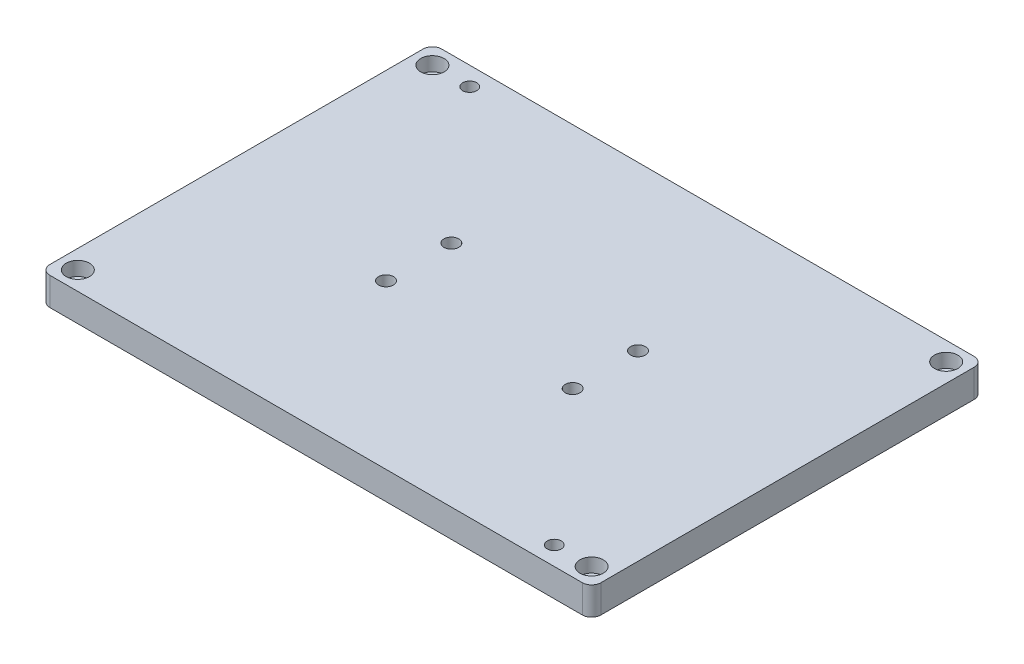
SolidWorks part; units mm, degrees
ref_plane "Front Plane" through (0, 0, 0) normal (0, 0, 1) x (1, 0, 0)
ref_plane "Top Plane" through (0, 0, 0) normal (0, 1, 0) x (1, 0, 0)
ref_plane "Right Plane" through (0, 0, 0) normal (1, 0, 0) x (0, 0, -1)
sketch "Sketch1" plane through (0, 0, 0) normal (0, 1, 0) x (1, 0, 0)
  line L1 (-187.5234, 133.35) -> (187.5234, 133.35)
  line L2 (-187.5234, 133.35) -> (-187.5234, -133.35)
  line L3 (-187.5234, -133.35) -> (187.5234, -133.35)
  line L4 (187.5234, 133.35) -> (187.5234, -133.35)
  line L5 (-187.5234, 133.35) -> (187.5234, -133.35) construction
  line L6 (-187.5234, -133.35) -> (187.5234, 133.35) construction
  point P0 (0, 0)
  dimension "D1" = 375.0469
  dimension "D2" = 266.7
extrude "Boss-Extrude1" add sketch "Sketch1" along normal blind 19.05
hole_wizard "1/8-27 NPSM Tapped Hole1" positions "Sketch4" profile "Sketch5" tap size "1/8-27 NPSM" standard "ANSI Inch"
sketch "Sketch4" plane through (0, 19.05, 0) normal (0, 1, 0) x (1, 0, 0)
  line L0 (162.1234, -88.9) -> (136.7234, -88.9) construction
  line L1 (136.7234, -88.9) -> (111.3234, -88.9) construction
  line L2 (111.3234, -88.9) -> (85.9234, -88.9) construction
  line L5 (187.5234, -133.35) -> (187.5234, 133.35) construction
  line L6 (-187.5234, -133.35) -> (187.5234, -133.35) construction
  point P0 (162.1234, -88.9)
  point P2 (136.7234, -88.9)
  point P4 (111.3234, -88.9)
  point P6 (85.9234, -88.9)
  dimension "D1" = 25.4
  dimension "D2" = 44.45
  dimension "D3" = 25.4
sketch "Sketch5" plane through (162.1234, 19.05, 88.9) normal (1, 0, 0) x (0, 0, 1)
  line L0 (0, 0) -> (0, 19.05)
  line L1 (0, 19.05) -> (4.5466, 19.05)
  line L2 (4.5466, 19.05) -> (4.5466, 0)
  line L5 (4.5466, 0) -> (0, 0)
  line L11 (0, -6.35) -> (0, 107.95) construction
  dimension "Thru Tap Drill Dia." = 9.0932
  dimension "Thru Tap Drill Depth" = 19.05
hole_wizard "CBORE for 3/8 Socket Head Cap Screw1" positions "Sketch6" profile "Sketch7" counterbore size "3/8" standard "ANSI Inch"
sketch "Sketch6" plane through (0, 19.05, 0) normal (0, 1, 0) x (1, 0, 0)
  line L0 (0, -133.35) -> (0, -73.2423) construction
  line L1 (-187.5234, -133.35) -> (187.5234, -133.35) construction
  line L3 (187.5234, 0) -> (84.8659, 0) construction
  line L4 (187.5234, -133.35) -> (187.5234, 133.35) construction
  point P0 (174.8234, -120.65)
  point P19 (174.8234, 120.65)
  point P20 (-174.8234, -120.65)
  point P21 (-174.8234, 120.65)
sketch "Sketch7" plane through (174.8234, 19.05, 120.65) normal (1, 0, 0) x (0, 0, 1)
  line L0 (0, 0) -> (0, 19.05)
  line L1 (0, 19.05) -> (5.0419, 19.05)
  line L3 (5.0419, 19.05) -> (5.0419, 9.525)
  line L4 (5.0419, 9.525) -> (7.9375, 9.525)
  line L5 (7.9375, 9.525) -> (7.9375, 0)
  line L7 (7.9375, 0) -> (0, 0)
  line L11 (0, -6.35) -> (0, 107.95) construction
  dimension "Thru Hole Dia." = 10.0838
  dimension "Thru Hole Depth" = 19.05
  dimension "C'Bore Dia." = 15.875
  dimension "C'Bore Depth" = 9.525
hole_wizard "3/8 (0.3750) Dowel Hole1" positions "Sketch8" profile "Sketch9" hole size "3/8" standard "ANSI Inch"
sketch "Sketch8" plane through (0, 19.05, 0) normal (0, 1, 0) x (1, 0, 0)
  line L0 (174.8234, -120.65) -> (149.4234, -120.65) construction
  line L2 (-174.8234, 120.65) -> (-149.4234, 120.65) construction
  point P0 (149.4234, -120.65)
  point P2 (-149.4234, 120.65)
  dimension "D1" = 25.4
sketch "Sketch9" plane through (149.4234, 19.05, 120.65) normal (1, 0, 0) x (0, 0, 1)
  line L0 (0, 0) -> (0, 19.05)
  line L1 (0, 19.05) -> (4.7625, 19.05)
  line L2 (4.7625, 19.05) -> (4.7625, 0)
  line L5 (4.7625, 0) -> (0, 0)
  line L11 (0, -6.35) -> (0, 107.95) construction
  dimension "Thru Hole Dia." = 9.525
  dimension "Thru Hole Depth" = 19.05
fillet "Fillet1" radius 6.35 4 edges at (187.5234, 9.525, 133.35) (-187.5234, 9.525, 133.35) (187.5234, 9.525, -133.35) (-187.5234, 9.525, -133.35)
hole_wizard "CBORE for 3/8 Socket Head Cap Screw2" positions "Sketch10" profile "Sketch11" counterbore size "3/8" standard "ANSI Inch"
sketch "Sketch10" plane through (0, 0, 0) normal (0, -1, 0) x (-1, 0, 0)
  point P0 (63.5, -22.225)
  point P3 (63.5, 22.225)
  point P6 (-63.5, -22.225)
  point P9 (-63.5, 22.225)
sketch "Sketch11" plane through (-63.5, 0, 22.225) normal (1, 0, 0) x (0, 0, -1)
  line L0 (0, 0) -> (0, 19.05)
  line L1 (0, 19.05) -> (5.0419, 19.05)
  line L3 (5.0419, 19.05) -> (5.0419, 9.525)
  line L4 (5.0419, 9.525) -> (7.9375, 9.525)
  line L5 (7.9375, 9.525) -> (7.9375, 0)
  line L7 (7.9375, 0) -> (0, 0)
  line L11 (0, -6.35) -> (0, 107.95) construction
  dimension "Thru Hole Dia." = 10.0838
  dimension "Thru Hole Depth" = 19.05
  dimension "C'Bore Dia." = 15.875
  dimension "C'Bore Depth" = 9.525
equation "\"D2@Sketch6\"=\"D1@Sketch6\""
